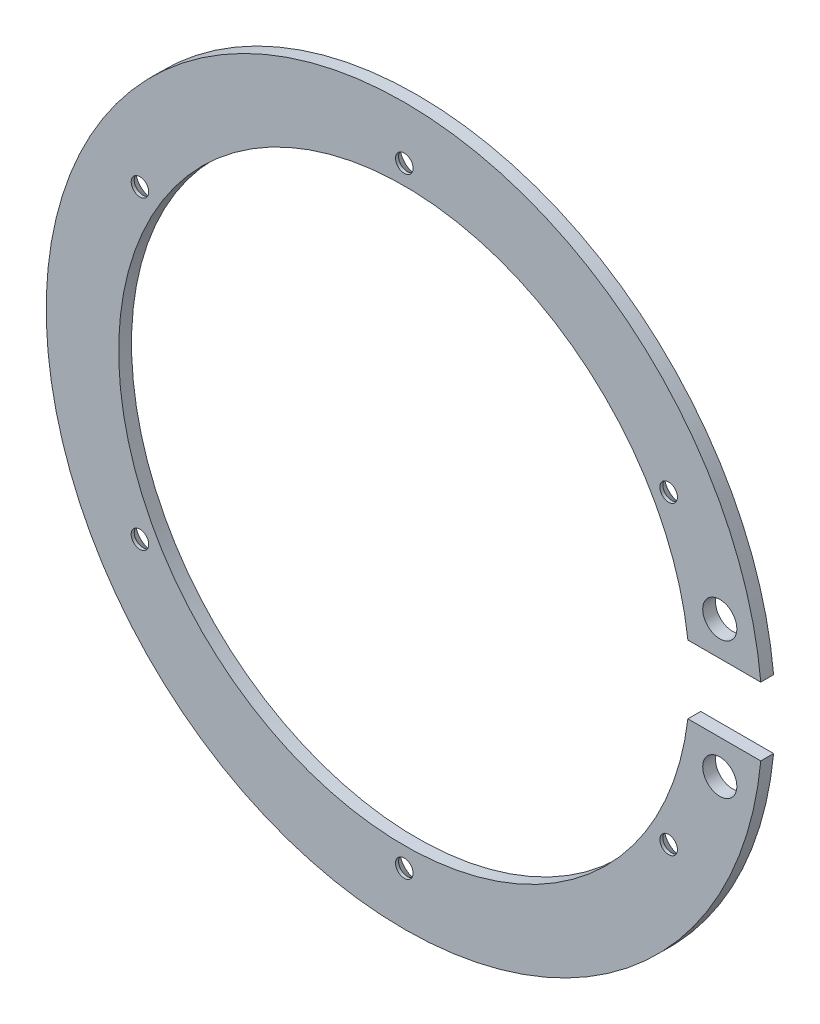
SolidWorks part; units mm, degrees
ref_plane "Front Plane" through (0, 0, 0) normal (0, 0, 1) x (1, 0, 0)
ref_plane "Top Plane" through (0, 0, 0) normal (0, 1, 0) x (1, 0, 0)
ref_plane "Right Plane" through (0, 0, 0) normal (1, 0, 0) x (0, 0, -1)
sketch "Sketch1" plane through (0, 0, 0) normal (0, 0, 1) x (1, 0, 0)
  circle A0 centre (0, 0) radius 133.35
  circle A1 centre (0, 0) radius 106.3625
  dimension "D1" = 266.7
  dimension "D2" = 212.725
extrude "Boss-Extrude1" add sketch "Sketch1" along normal blind 4.7752
hole_wizard "CSK for 1/4 Flat Head Machine Screw2" positions "Sketch3" profile "Sketch2" countersink size "1/4" standard "Ansi Inch"
sketch "Sketch3" plane through (0, 0, 0) normal (0, 0, -1) x (-1, 0, 0)
  line L0 (0, 55) -> (0, -55) construction
  point P0 (0, 113.665)
  dimension "D1" = 113.665
sketch "Sketch2" plane through (0, 113.665, 0) normal (1, 0, 0) x (0, 1, 0)
  line L0 (0, 0) -> (0, 4.7752)
  line L1 (0, 4.7752) -> (3.2639, 4.7752)
  line L2 (3.2639, 4.7752) -> (3.2639, 3.6524)
  line L3 (3.2639, 3.6524) -> (6.4389, 0)
  line L5 (6.4389, 0) -> (0, 0)
  line L6 (-3.2639, 3.6524) -> (-6.4389, 0) construction
  line L11 (0, -6.35) -> (0, 107.95) construction
  dimension "Thru Hole Dia." = 6.5278
  dimension "Thru Hole Depth" = 4.7752
  dimension "Near C'Sink Dia." = 12.8778
  dimension "Near C'Sink Angle" = 82
pattern_circular "CirPattern1" count 6 over 360 about axis through (0, 0, 0) along (0, 0, 1) of "CSK for 1/4 Flat Head Machine Screw2"
sketch "Sketch4" plane through (0, 0, 0) normal (0, 0, -1) x (-1, 0, 0)
  line L0 (0, 0) -> (-133.35, 0) construction
  line L1 (-133.35, 0) -> (-133.35, 12.7)
  line L2 (-133.35, 12.7) -> (-105.6016, 12.7)
  line L3 (-105.6016, 12.7) -> (-105.6016, -12.7)
  line L4 (-105.6016, -12.7) -> (-133.35, -12.7)
  line L5 (-133.35, -12.7) -> (-133.35, 0)
  line L6 (-117.475, 25.4) -> (-117.475, -25.4) construction
  circle A0 centre (0, 0) radius 133.35 construction
  circle A1 centre (-117.475, 25.4) radius 6.35
  circle A2 centre (-117.475, -25.4) radius 6.35
  circle A3 centre (0, 0) radius 106.3625 construction
  dimension "D3" = 12.7
  dimension "D5" = 25.4
  dimension "D1" = 25.4
  dimension "D2" = 12.7
  dimension "D4" = 50.8
  dimension "D6" = 15.875
extrude "Cut-Extrude1" cut sketch "Sketch4" against normal through all
